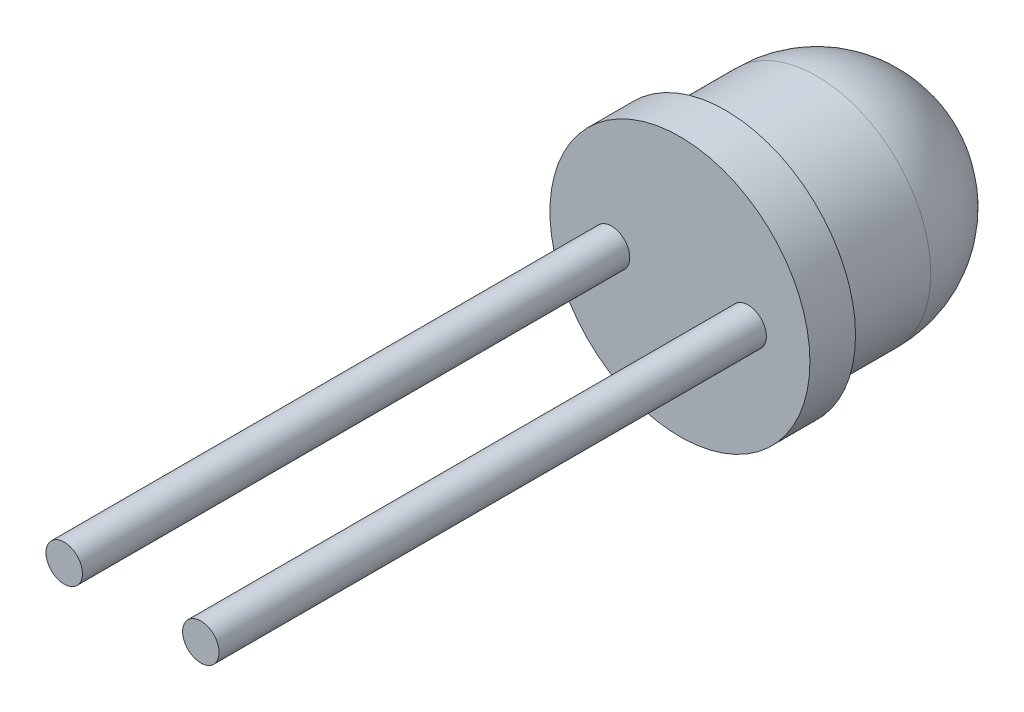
SolidWorks part; units mm, degrees
ref_plane "Plan1" through (0, 0, 0) normal (0, 0, 1) x (1, 0, 0)
ref_plane "Plan2" through (0, 0, 0) normal (0, 1, 0) x (1, 0, 0)
ref_plane "Plan3" through (0, 0, 0) normal (1, 0, 0) x (0, 0, -1)
sketch "Esquisse3" plane through (0, 0, 0) normal (0, 0, 1) x (1, 0, 0)
  circle A0 centre (0, 0) radius 2.5
  dimension "D1" = 5
extrude "Base-Extrusion" add sketch "Esquisse3" along normal blind 5.5
fillet "Congé3" radius 2.5
sketch "Esquisse4" plane through (0, 0, 5.5) normal (0, 0, 1) x (1, 0, 0)
  circle A0 centre (0, 0) radius 2.85
  dimension "D1" = 5.7
extrude "Boss.-Extru.1" add sketch "Esquisse4" against normal blind 1
sketch "Esquisse5" plane through (0, 0, 5.5) normal (0, 0, 1) x (1, 0, 0)
  circle A0 centre (-1.5, 0) radius 0.4
  circle A1 centre (1.4952, 0) radius 0.4
  dimension "D1" = 1.5
  dimension "D2" = 1.4952
extrude "Boss.-Extru.2" add sketch "Esquisse5" along normal blind 12
